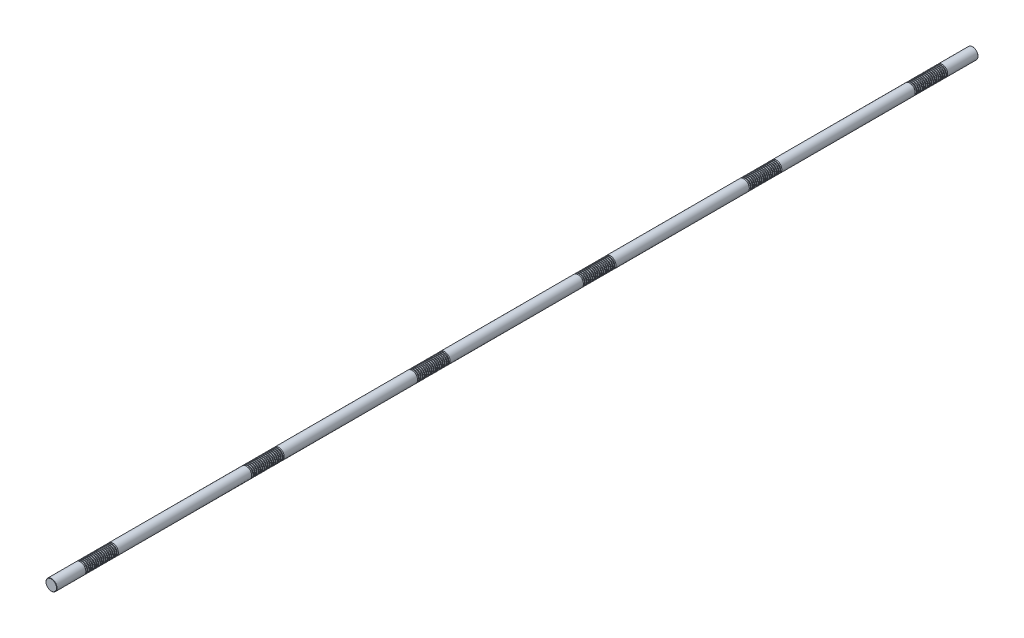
SolidWorks part; units mm, degrees
ref_plane "Front Plane" through (0, 0, 0) normal (0, 0, 1) x (1, 0, 0)
ref_plane "Top Plane" through (0, 0, 0) normal (0, 1, 0) x (1, 0, 0)
ref_plane "Right Plane" through (0, 0, 0) normal (1, 0, 0) x (0, 0, -1)
sketch "Sketch1" plane through (0, 0, 0) normal (0, 0, 1) x (1, 0, 0)
  circle A0 centre (0, 0) radius 18
  dimension "D1" = 36
extrude "Boss-Extrude1" add sketch "Sketch1" along normal mid plane 3000
chamfer "Chamfer1" distance 0.9 angle 45 2 edges at (18, 0, -1500) (18, 0, 1500)
sketch "Sketch2" plane through (0, 0, 0) normal (1, 0, 0) x (0, 0, -1)
  line L0 (1400.4689, 18) -> (1396.5311, 18)
  line L1 (1499.1, 18) -> (-1499.1, 18) construction
  line L2 (1396.5311, 18) -> (1397.4689, 14.5)
  line L3 (1397.4689, 14.5) -> (1399.5311, 14.5)
  line L4 (1399.5311, 14.5) -> (1400.4689, 18)
  line L5 (1500, -17.1) -> (1500, 17.1) construction
  point P4 (1398.5, 18)
  point P7 (1398.5, 14.5)
  point P8 (1400, 16.25)
  point P9 (1397, 16.25)
  dimension "D1" = 3
  dimension "D2" = 100
  dimension "D3" = 3.5
  dimension "D4" = 30
revolve "Cut-Revolve1" cut sketch "Sketch2" angle 360 about axis through (0, 0, 1500) along (0, 0, -1)
pattern_linear "LPattern1" count 18 spacing 6 along (0, 0, 1) of "Cut-Revolve1"
pattern_linear "LPattern2" count 6 spacing 540 along (0, 0, 1) of "Cut-Revolve1", "LPattern1"
